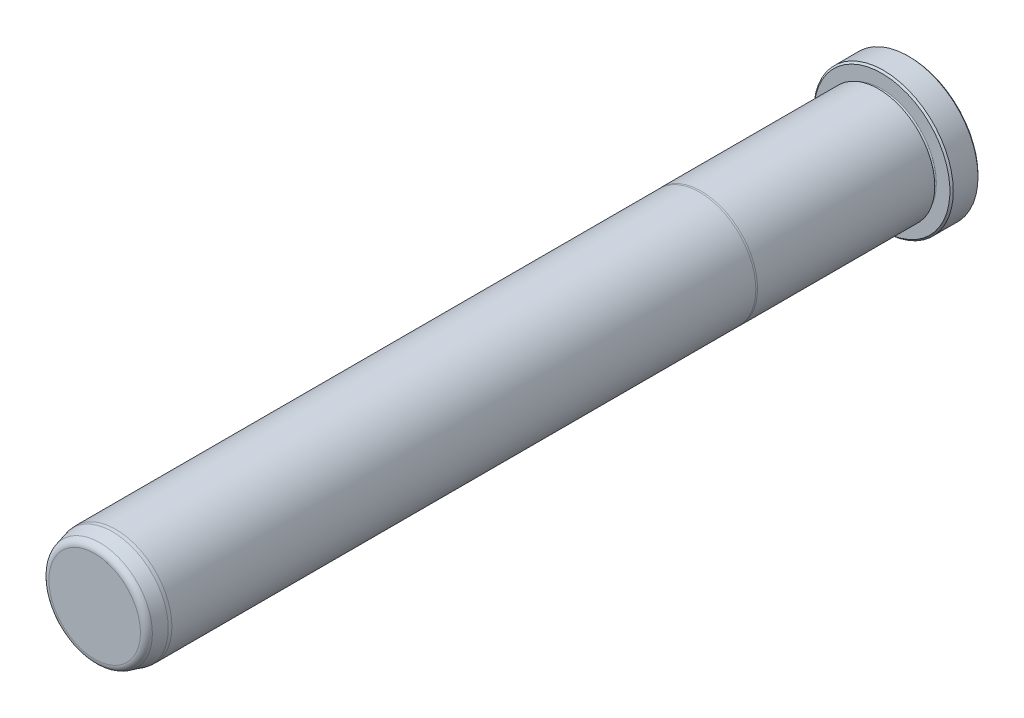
SolidWorks part; units mm, degrees
ref_plane "Front Plane" through (0, 0, 0) normal (0, 0, 1) x (1, 0, 0)
ref_plane "Top Plane" through (0, 0, 0) normal (0, 1, 0) x (1, 0, 0)
ref_plane "Right Plane" through (0, 0, 0) normal (1, 0, 0) x (0, 0, -1)
sketch "Sketch1" plane through (0, 0, 0) normal (1, 0, 0) x (0, 0, -1)
  line L0 (0, 0) -> (0, 15.748)
  line L1 (0, 15.748) -> (-6.35, 15.748)
  line L2 (-6.35, 15.748) -> (-6.35, 12.3063)
  line L3 (-6.35, 11.9253) -> (-7.112, 11.9253) construction
  line L4 (-7.112, 12.3063) -> (-7.112, 12.7127)
  line L5 (-7.112, 12.7127) -> (-47.1348, 12.7127)
  line L6 (-47.1348, 12.7127) -> (-47.498, 12.6873)
  line L7 (-47.498, 12.6873) -> (-179.3875, 12.6873)
  line L9 (-184.15, 11.5487) -> (-184.15, 0)
  line L10 (-184.15, 0) -> (0, 0)
  line L11 (0, 0) -> (13.6287, 0) construction
  line L12 (-179.3875, 12.6873) -> (-180.1495, 12.6206)
  line L13 (-180.1495, 12.6206) -> (-184.15, 11.5487)
  arc A0 (-7.112, 12.3063) -> (-6.35, 12.3063) centre (-6.731, 12.3063) ccw
  dimension "D14" = 0.762
  dimension "D1" = 6.35
  dimension "D2" = 0.762
  dimension "D3" = 31.496
  dimension "D4" = 25.4254
  dimension "D5" = 47.498
  dimension "D6" = 184.15
  dimension "D7" = 0.7874
  dimension "D8" = 4
  dimension "D9" = 25.3746
  dimension "D10" = 5
  dimension "D11" = 15
  dimension "D12" = 0.762
  dimension "D13" = 4.7625
revolve "Revolve1" add sketch "Sketch1" angle 360 about L11
fillet "Fillet6" radius 1.5875 1 edges at (11.5487, 0, 184.15)
chamfer "Chamfer1" distance 0.381 angle 45 2 edges at (15.748, 0, 0) (15.748, 0, 6.35)
